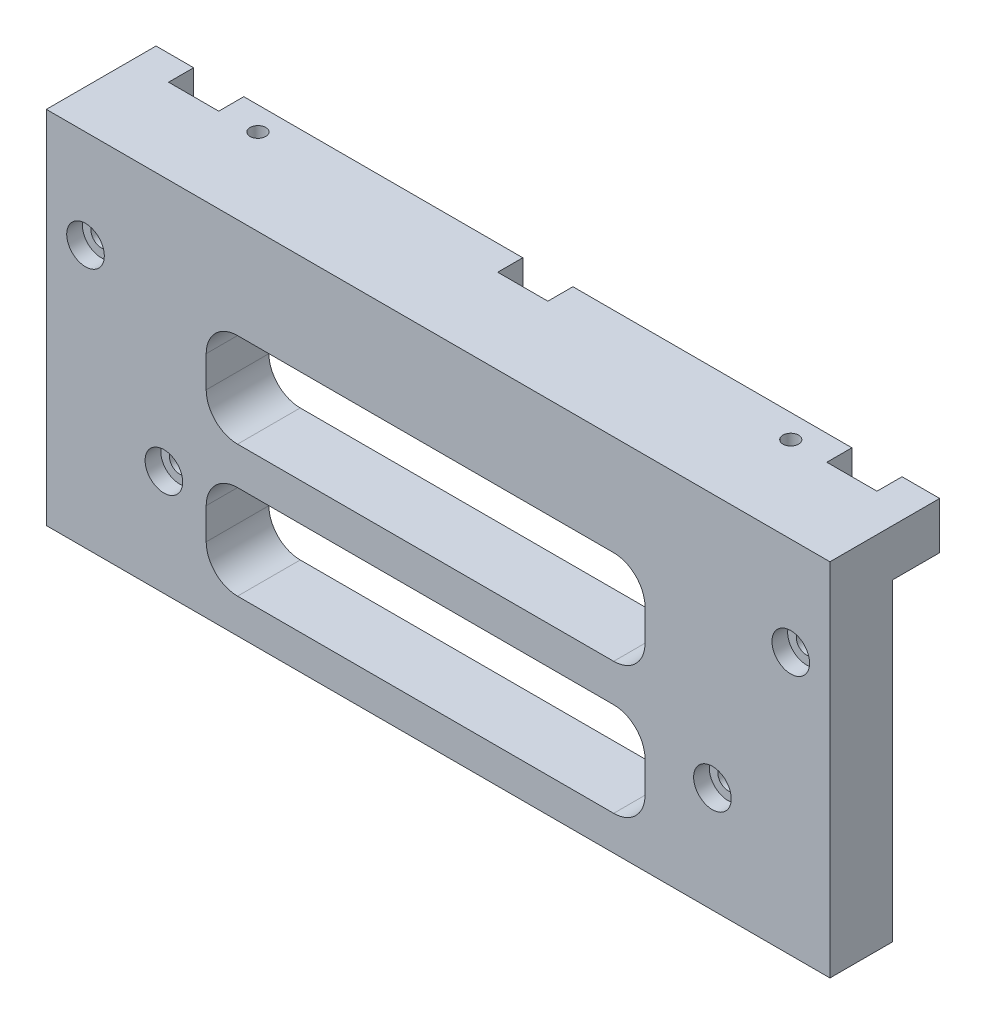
SolidWorks part; units mm, degrees
ref_plane "Plan de face" through (0, 0, 0) normal (0, 0, 1) x (1, 0, 0)
ref_plane "Plan de dessus" through (0, 0, 0) normal (0, 1, 0) x (1, 0, 0)
ref_plane "Plan de droite" through (0, 0, 0) normal (1, 0, 0) x (0, 0, -1)
sketch "Esquisse1" plane through (0, 0, 0) normal (0, 0, 1) x (1, 0, 0)
  line L1 (0, 0) -> (250, 0)
  line L2 (0, 0) -> (0, 115)
  line L3 (0, 115) -> (250, 115)
  line L4 (250, 0) -> (250, 115)
  dimension "D1" = 250
  dimension "D2" = 115
extrude "Boss.-Extru.1" add sketch "Esquisse1" along normal blind 20
sketch "Esquisse2" plane through (0, 0, 20) normal (0, 0, 1) x (1, 0, 0)
  line L0 (250, 0) -> (250, 115) construction
  line L1 (51, 83) -> (191, 83)
  line L2 (51, 83) -> (51, 53)
  line L3 (51, 53) -> (191, 53)
  line L4 (191, 83) -> (191, 53)
  line L5 (51, 41) -> (191, 41)
  line L6 (51, 41) -> (51, 11)
  line L7 (51, 11) -> (191, 11)
  line L8 (191, 41) -> (191, 11)
  line L17 (250, 0) -> (250, 115) construction
  line L19 (0, 0) -> (250, 0) construction
  dimension "D1" = 30
  dimension "D2" = 140
  dimension "D3" = 59
  dimension "D4" = 59
  dimension "D5" = 140
  dimension "D6" = 30
  dimension "D7" = 53
  dimension "D8" = 11
extrude "Enlèv. mat.-Extru.1" cut sketch "Esquisse2" against normal through all
sketch "Esquisse4" plane through (0, 0, 0) normal (0, 0, -1) x (-1, 0, 0)
  line L0 (0, 115) -> (0, 0) construction
  line L1 (-250, 115) -> (0, 115)
  line L2 (-250, 115) -> (-250, 100)
  line L3 (-250, 100) -> (0, 100)
  line L4 (0, 115) -> (0, 100)
  dimension "D1" = 15
extrude "Boss.-Extru.2" add sketch "Esquisse4" along normal blind 15
sketch "Esquisse7" plane through (0, 100, 0) normal (0, -1, 0) x (1, 0, 0)
  line L0 (250, -15) -> (0, -15) construction
  line L1 (0, -15) -> (0, 0) construction
  line L2 (250, -15) -> (250, 0) construction
  circle A0 centre (40, -7.5) radius 2.5
  circle A1 centre (210, -7.5) radius 2.5
  point P10 (250, -7.5)
  dimension "D1" = 5
  dimension "D2" = 5
  dimension "D4" = 7.5
  dimension "D3" = 7.5
  dimension "D5" = 40
  dimension "D6" = 40
extrude "Enlèv. mat.-Extru.3" cut sketch "Esquisse7" against normal through all
sketch "Esquisse8" plane through (0, 0, 0) normal (0, 0, -1) x (-1, 0, 0)
  line L0 (0, 100) -> (0, 0) construction
  line L1 (0, 0) -> (-250, 0) construction
  circle A0 centre (-37.5, 33.75) radius 3.25
  circle A1 centre (-12.5, 83.75) radius 3.25
  circle A2 centre (-212.5, 33.75) radius 3.25
  circle A3 centre (-237.5, 83.75) radius 3.25
  dimension "D3" = 6.5
  dimension "D4" = 6.5
  dimension "D5" = 6.5
  dimension "D6" = 6.5
  dimension "D8" = 50
  dimension "D10" = 50
  dimension "D11" = 25
  dimension "D1" = 37.5
  dimension "D2" = 33.75
  dimension "D7" = 25
  dimension "D9" = 175
  dimension "D12" = 33.75
extrude "Enlèv. mat.-Extru.4" cut sketch "Esquisse8" against normal through all
sketch "Esquisse9" plane through (0, 0, 0) normal (0, 0, -1) x (-1, 0, 0)
  circle A0 centre (-37.5, 33.75) radius 6
  circle A1 centre (-12.5, 83.75) radius 6
  circle A4 centre (-212.5, 33.75) radius 6
  circle A5 centre (-237.5, 83.75) radius 6
  dimension "D1" = 12
  dimension "D2" = 12
  dimension "D3" = 12
  dimension "D4" = 12
extrude "Enlèv. mat.-Extru.5" cut sketch "Esquisse9" against normal blind 7
sketch "Esquisse10" plane through (0, 0, 20) normal (0, 0, 1) x (1, 0, 0)
  circle A0 centre (37.5, 33.75) radius 6
  circle A1 centre (12.5, 83.75) radius 6
  circle A2 centre (237.5, 83.75) radius 6
  circle A3 centre (212.5, 33.75) radius 6
  dimension "D1" = 12
  dimension "D2" = 12
  dimension "D3" = 12
  dimension "D4" = 12
extrude "pietage centrage" cut sketch "Esquisse10" against normal blind 5
fillet "Congé1" radius 10 8 edges at (51, 11, 10) (191, 11, 10) (191, 53, 10) (191, 41, 10) (191, 83, 10) (51, 41, 10) (51, 83, 10) (51, 53, 10)
sketch "Esquisse11" plane through (0, 115, 0) normal (0, 1, 0) x (1, 0, 0)
  line L0 (0, 15) -> (250, 15) construction
  line L1 (12, 15) -> (28, 15)
  line L2 (12, 15) -> (12, 7)
  line L3 (12, 7) -> (28, 7)
  line L4 (28, 15) -> (28, 7)
  line L5 (0, -20) -> (0, 15) construction
  line L6 (117, 15) -> (133, 15)
  line L7 (117, 15) -> (117, 7)
  line L8 (117, 7) -> (133, 7)
  line L9 (133, 15) -> (133, 7)
  line L10 (222, 15) -> (238, 15)
  line L11 (222, 15) -> (222, 7)
  line L12 (222, 7) -> (238, 7)
  line L13 (238, 15) -> (238, 7)
  dimension "D1" = 8
  dimension "D2" = 8
  dimension "D3" = 8
  dimension "D4" = 16
  dimension "D5" = 16
  dimension "D6" = 16
  dimension "D7" = 117
  dimension "D8" = 89
  dimension "D9" = 89
extrude "Enlèv. mat.-Extru.6" cut sketch "Esquisse11" against normal up to next
